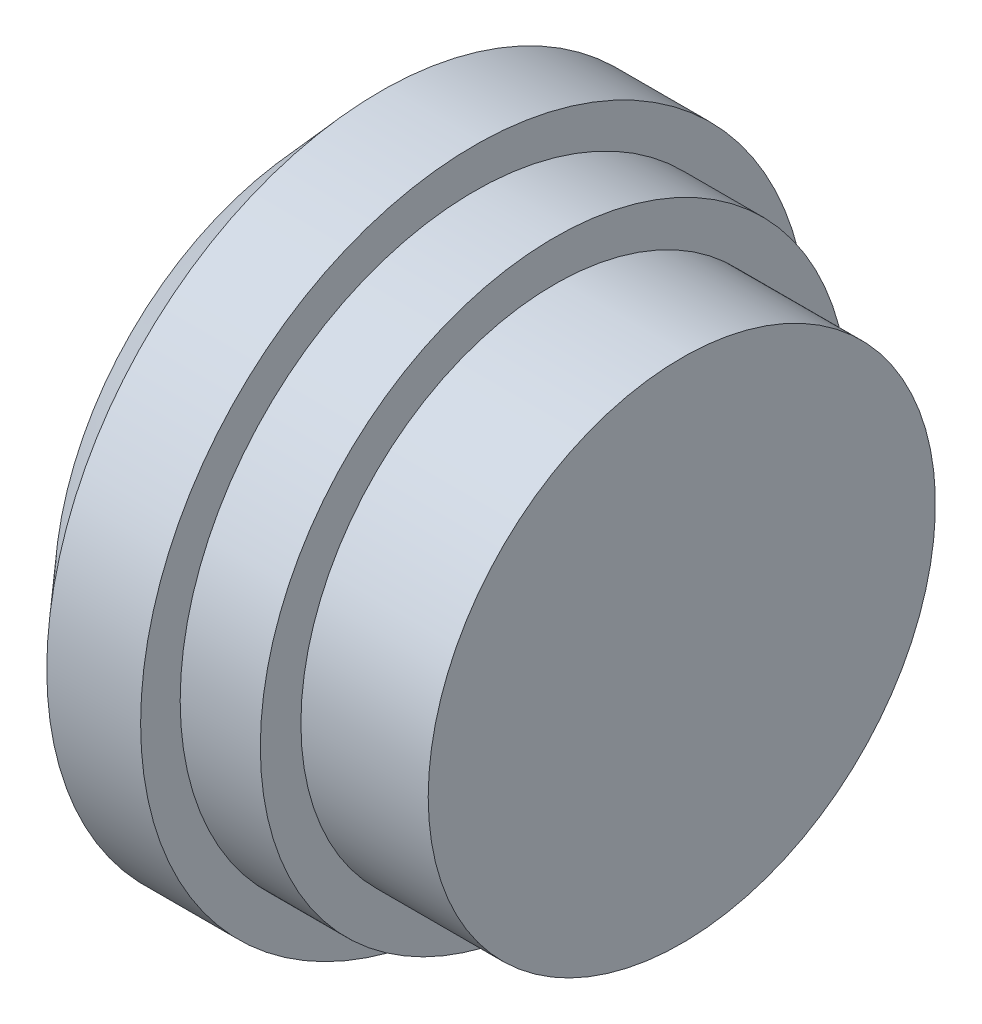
SolidWorks part; units mm, degrees
ref_plane "Front Plane" through (0, 0, 0) normal (0, 0, 1) x (1, 0, 0)
ref_plane "Top Plane" through (0, 0, 0) normal (0, 1, 0) x (1, 0, 0)
ref_plane "Right Plane" through (0, 0, 0) normal (1, 0, 0) x (0, 0, -1)
sketch "Sketch1" plane through (0, 0, 0) normal (0, 0, 1) x (1, 0, 0)
  line L0 (0, 0) -> (-6.3754, 0)
  line L1 (-6.3754, 0) -> (-6.3754, -2.032)
  line L2 (-6.3754, -2.032) -> (-10.3886, -2.032)
  line L3 (-10.3886, -2.032) -> (-10.3886, -4.0132)
  line L4 (-10.3886, -4.0132) -> (-15.0876, -4.0132)
  line L5 (-15.0876, -4.0132) -> (-18.288, -0.4318)
  line L6 (-18.288, -0.4318) -> (-18.288, 12.7)
  line L7 (-18.288, 12.7) -> (0, 12.7)
  line L8 (0, 12.7) -> (0, 0)
  dimension "D1" = 12.7
  dimension "D2" = 18.288
  dimension "D3" = 7.8994
  dimension "D4" = 11.9126
  dimension "D5" = 3.2004
  dimension "D6" = 13.1318
  dimension "D7" = 16.7132
  dimension "D8" = 14.732
revolve "Revolve1" add sketch "Sketch1" angle 360 about L7
sketch "Sketch4" plane through (-18.288, 0, 0) normal (-1, 0, 0) x (0, 0, 1)
  circle A0 centre (0, 12.7) radius 11.049
extrude "Cut-Extrude1" cut sketch "Sketch4" against normal blind 17.4625 contours A0
